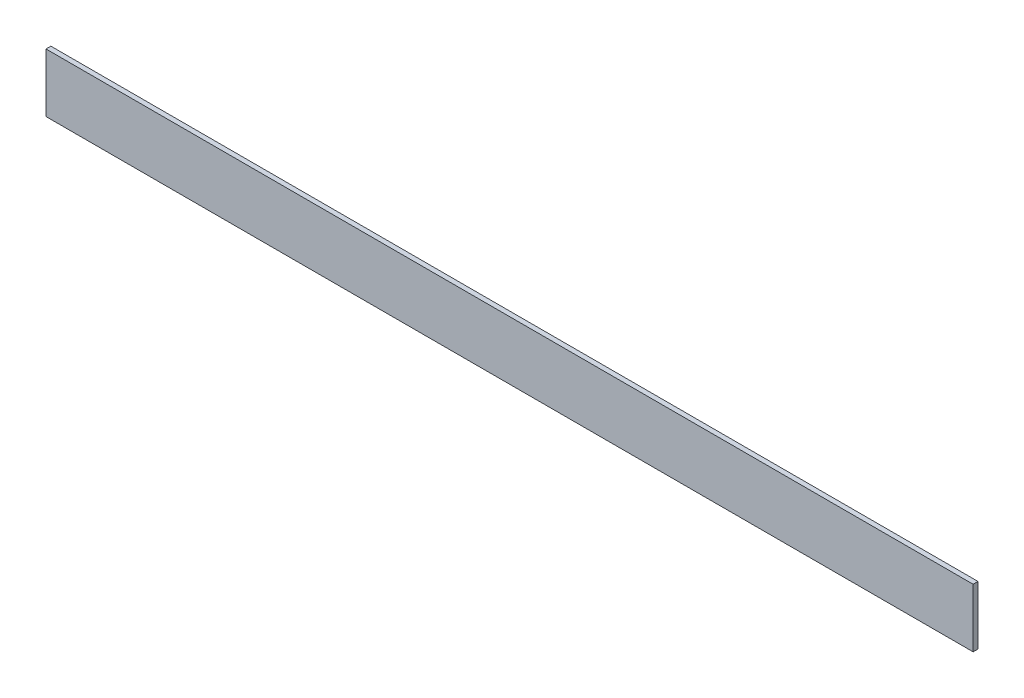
SolidWorks part; units mm, degrees
ref_plane "Front Plane" through (0, 0, 0) normal (0, 0, 1) x (1, 0, 0)
ref_plane "Top Plane" through (0, 0, 0) normal (0, 1, 0) x (1, 0, 0)
ref_plane "Right Plane" through (0, 0, 0) normal (1, 0, 0) x (0, 0, -1)
sketch "Sketch1" plane through (0, 0, 0) normal (0, 0, 1) x (1, 0, 0)
  line L1 (-603.25, -38.1) -> (603.25, -38.1)
  line L2 (-603.25, -38.1) -> (-603.25, 38.1)
  line L3 (-603.25, 38.1) -> (603.25, 38.1)
  line L4 (603.25, -38.1) -> (603.25, 38.1)
  line L5 (-603.25, -38.1) -> (603.25, 38.1) construction
  line L6 (-603.25, 38.1) -> (603.25, -38.1) construction
  point P0 (0, 0)
  dimension "D1" = 76.2
  dimension "D2" = 1206.5
extrude "Boss-Extrude1" add sketch "Sketch1" along normal blind 6.35
